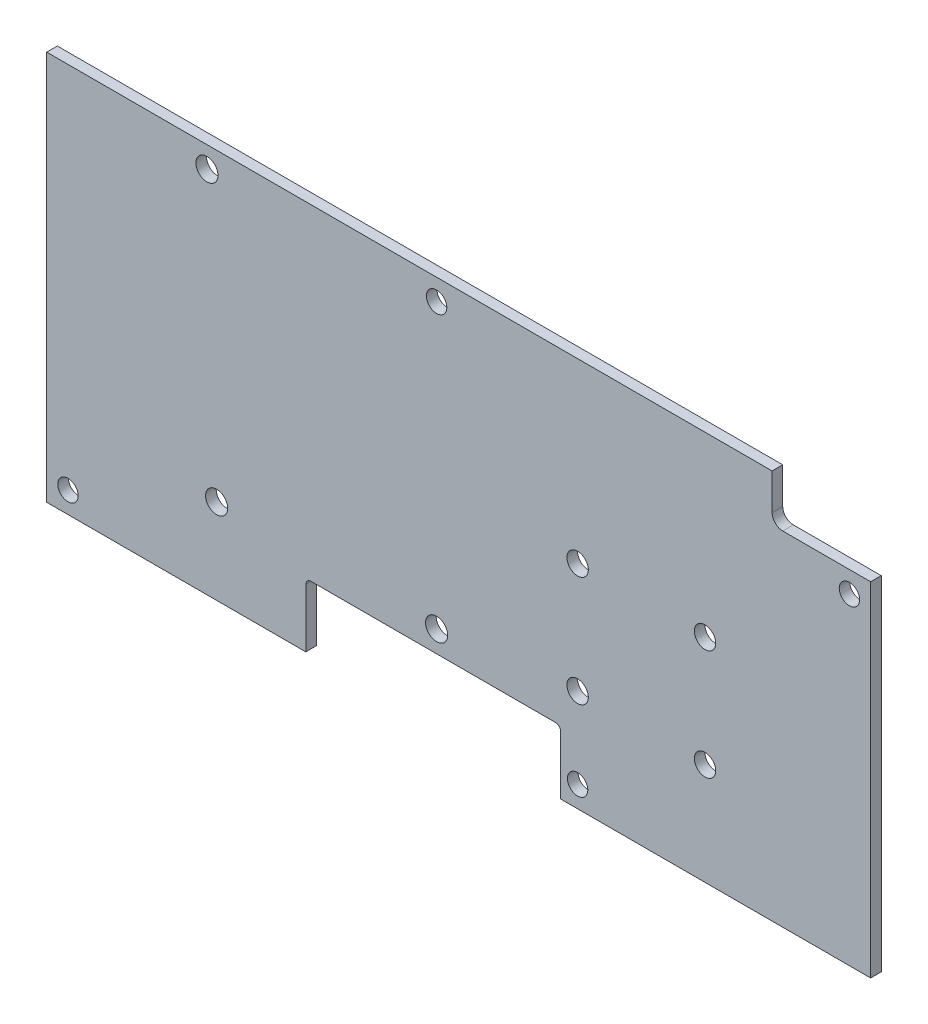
SolidWorks part; units mm, degrees
ref_plane "Front Plane" through (0, 0, 0) normal (0, 0, 1) x (1, 0, 0)
ref_plane "Top Plane" through (0, 0, 0) normal (0, 1, 0) x (1, 0, 0)
ref_plane "Right Plane" through (0, 0, 0) normal (1, 0, 0) x (0, 0, -1)
sketch "Sketch1" plane through (0, 0, 0) normal (0, 0, 1) x (1, 0, 0)
  line L1 (0, 0) -> (167.64, 0)
  line L2 (0, 0) -> (0, 165.1)
  line L3 (0, 165.1) -> (167.64, 165.1)
  line L4 (167.64, 0) -> (167.64, 165.1)
  dimension "D1" = 165.1
  dimension "D2" = 167.64
extrude "pcb" add sketch "Sketch1" along normal blind 1.5875
sketch "Sketch4" plane through (0, 0, 1.5875) normal (0, 0, 1) x (1, 0, 0)
  line L0 (167.64, 82.55) -> (0, 82.55) construction
  line L1 (167.64, 0) -> (167.64, 165.1) construction
  line L3 (167.64, 165.1) -> (0, 165.1) construction
  line L4 (0, 165.1) -> (0, 0) construction
  line L5 (20.32, 82.55) -> (20.32, 95.25) construction
  circle A0 centre (162.8775, 95.25) radius 1.524
  circle A1 centre (162.8775, 69.85) radius 1.524
  circle A2 centre (163.83, 161.29) radius 1.524
  circle A3 centre (163.83, 3.81) radius 1.524
  circle A4 centre (3.81, 161.29) radius 1.524
  circle A5 centre (3.81, 3.81) radius 1.524
  circle A6 centre (162.8775, 82.55) radius 1.524
  circle A7 centre (20.32, 95.25) radius 1.524
  circle A8 centre (20.32, 82.55) radius 1.524
  circle A9 centre (20.32, 69.85) radius 1.524
  dimension "D1" = 3.048
  dimension "D4" = 3.048
  dimension "D5" = 3.81
  dimension "D6" = 3.81
  dimension "D7" = 3.048
  dimension "D8" = 3.81
  dimension "D9" = 3.81
  dimension "D10" = 3.048
  dimension "D13" = 3.048
  dimension "D14" = 3.048
  dimension "D2" = 12.7
  dimension "D3" = 4.7625
  dimension "D11" = 12.7
  dimension "D12" = 20.32
extrude "mount_holes" cut sketch "Sketch4" against normal blind 3.175
sketch "Sketch5" plane through (0, 0, 1.5875) normal (0, 0, 1) x (1, 0, 0)
  line L0 (0, 165.1) -> (0, 0) construction
  line L1 (1.27, 90.17) -> (13.97, 90.17)
  line L2 (1.27, 90.17) -> (1.27, 55.88)
  line L3 (1.27, 55.88) -> (13.97, 55.88)
  line L4 (13.97, 90.17) -> (13.97, 55.88)
  line L5 (0, 0) -> (167.64, 0) construction
  dimension "D1" = 12.7
  dimension "D2" = 34.29
  dimension "D3" = 1.27
  dimension "D4" = 55.88
extrude "20pinMicrofit" add sketch "Sketch5" along normal blind 7.62
sketch "Sketch6" plane through (0, 0, 1.5875) normal (0, 0, 1) x (1, 0, 0)
  line L1 (1.27, 33.02) -> (13.97, 33.02)
  line L2 (1.27, 33.02) -> (1.27, 53.34)
  line L3 (1.27, 53.34) -> (13.97, 53.34)
  line L4 (13.97, 33.02) -> (13.97, 53.34)
  line L5 (0, 165.1) -> (0, 0) construction
  line L6 (0, 0) -> (167.64, 0) construction
  dimension "D1" = 20.32
  dimension "D2" = 12.7
  dimension "D3" = 33.02
  dimension "D4" = 1.27
extrude "sbeRibbon" add sketch "Sketch6" along normal blind 9.144
sketch "Sketch7" plane through (0, 0, 1.5875) normal (0, 0, 1) x (1, 0, 0)
  line L0 (0, 165.1) -> (0, 0) construction
  line L1 (1.27, 20.32) -> (13.97, 20.32)
  line L2 (1.27, 20.32) -> (1.27, 30.48)
  line L3 (1.27, 30.48) -> (13.97, 30.48)
  line L4 (13.97, 20.32) -> (13.97, 30.48)
  line L5 (0, 0) -> (167.64, 0) construction
  dimension "D1" = 12.7
  dimension "D2" = 10.16
  dimension "D3" = 1.27
  dimension "D4" = 20.32
extrude "4pinMicrofit" add sketch "Sketch7" along normal blind 7.62
sketch "Sketch8" plane through (0, 0, 1.5875) normal (0, 0, 1) x (1, 0, 0)
  line L0 (0, 165.1) -> (0, 0) construction
  line L1 (1.27, 7.62) -> (11.43, 7.62)
  line L2 (1.27, 7.62) -> (1.27, 17.78)
  line L3 (1.27, 17.78) -> (11.43, 17.78)
  line L4 (11.43, 7.62) -> (11.43, 17.78)
  line L6 (0, 0) -> (167.64, 0) construction
  dimension "D1" = 10.16
  dimension "D2" = 10.16
  dimension "D3" = 1.27
  dimension "D4" = 7.62
extrude "2pinMicrofit" add sketch "Sketch8" along normal blind 5.08
sketch "Sketch9" plane through (0, 0, 1.5875) normal (0, 0, 1) x (1, 0, 0)
  line L0 (0, 0) -> (167.64, 0) construction
  line L1 (0, 165.1) -> (0, 0) construction
  line L2 (27.94, 8.89) -> (104.14, 8.89) construction
  line L3 (27.94, 8.89) -> (27.94, 52.07) construction
  line L4 (27.94, 52.07) -> (104.14, 52.07) construction
  line L5 (104.14, 8.89) -> (104.14, 52.07) construction
  circle A0 centre (27.94, 8.89) radius 1.524
  circle A1 centre (27.94, 52.07) radius 1.524
  circle A2 centre (104.14, 52.07) radius 1.524
  circle A3 centre (104.14, 8.89) radius 1.524
  dimension "D1" = 3.048
  dimension "D2" = 3.048
  dimension "D3" = 3.048
  dimension "D4" = 3.048
  dimension "D6" = 43.18
  dimension "D5" = 8.89
  dimension "D7" = 76.2
  dimension "D8" = 27.94
extrude "hyd_board_holes" cut sketch "Sketch9" against normal blind 10.16
sketch "Sketch10" plane through (0, 0, 1.5875) normal (0, 0, 1) x (1, 0, 0)
  line L0 (0, 165.1) -> (0, 0) construction
  line L1 (167.64, 165.1) -> (0, 165.1) construction
  line L2 (144.78, 161.29) -> (144.78, 129.159) construction
  line L3 (144.78, 129.159) -> (0, 129.159) construction
  circle A0 centre (144.78, 161.29) radius 1.524
  circle A1 centre (83.058, 154.305) radius 1.524
  circle A2 centre (14.732, 153.035) radius 1.524
  circle A3 centre (144.78, 97.028) radius 1.524
  circle A4 centre (83.058, 104.013) radius 1.524
  circle A5 centre (14.732, 105.283) radius 1.524
  dimension "D1" = 3.048
  dimension "D3" = 3.81
  dimension "D5" = 3.048
  dimension "D6" = 3.048
  dimension "D7" = 25.146
  dimension "D8" = 23.876
  dimension "D10" = 68.326
  dimension "D2" = 144.78
  dimension "D4" = 32.131
  dimension "D9" = 61.722
extrude "sbd_mount_holes" cut sketch "Sketch10" against normal blind 5.588
sketch "Sketch11" plane through (0, 0, 1.5875) normal (0, 0, 1) x (1, 0, 0)
  line L0 (0, 165.1) -> (0, 0) construction
  line L1 (63.5, 146.05) -> (127, 146.05) construction
  line L2 (63.5, 146.05) -> (63.5, 120.65) construction
  line L3 (63.5, 120.65) -> (127, 120.65) construction
  line L4 (127, 146.05) -> (127, 120.65) construction
  line L5 (167.64, 165.1) -> (0, 165.1) construction
  line L6 (127, 146.05) -> (127, 152.4) construction
  line L7 (127, 133.35) -> (63.5, 133.35) construction
  circle A0 centre (63.5, 146.05) radius 1.524
  circle A1 centre (127, 152.4) radius 1.524
  circle A2 centre (63.5, 120.65) radius 1.524
  circle A3 centre (127, 114.3) radius 1.524
  dimension "D6" = 3.048
  dimension "D7" = 3.048
  dimension "D8" = 3.048
  dimension "D1" = 63.5
  dimension "D2" = 63.5
  dimension "D3" = 25.4
  dimension "D4" = 19.05
  dimension "D5" = 6.35
extrude "gps_mount_holes" cut sketch "Sketch11" against normal blind 5.588
sketch "Sketch12" plane through (0, 0, 0) normal (0, 0, -1) x (-1, 0, 0)
  line L0 (-167.64, 165.1) -> (0, 165.1) construction
  line L1 (-137.16, 163.195) -> (-121.412, 163.195)
  line L2 (-137.16, 163.195) -> (-137.16, 158.115)
  line L3 (-137.16, 158.115) -> (-121.412, 158.115)
  line L4 (-121.412, 163.195) -> (-121.412, 158.115)
  line L5 (-167.64, 0) -> (-167.64, 165.1) construction
  dimension "D1" = 15.748
  dimension "D2" = 5.08
  dimension "D3" = 6.985
  dimension "D4" = 30.48
extrude "sbd_conn" add sketch "Sketch12" along normal blind 9.906
sketch "Sketch13" plane through (0, 0, 0) normal (0, 0, -1) x (-1, 0, 0)
  line L0 (-167.64, 0) -> (-167.64, 165.1) construction
  line L1 (-161.29, 7.62) -> (-147.32, 7.62)
  line L2 (-161.29, 7.62) -> (-161.29, 20.32)
  line L3 (-161.29, 20.32) -> (-147.32, 20.32)
  line L4 (-147.32, 7.62) -> (-147.32, 20.32)
  line L5 (0, 0) -> (-167.64, 0) construction
  dimension "D1" = 13.97
  dimension "D2" = 12.7
  dimension "D3" = 6.35
  dimension "D4" = 7.62
extrude "compass_conn" add sketch "Sketch13" along normal blind 6.35
sketch "Sketch14" plane through (0, 0, 0) normal (0, 0, -1) x (-1, 0, 0)
  line L0 (-167.64, 0) -> (-167.64, 165.1) construction
  line L1 (-158.75, 21.59) -> (-146.05, 21.59)
  line L2 (-158.75, 21.59) -> (-158.75, 41.91)
  line L3 (-158.75, 41.91) -> (-146.05, 41.91)
  line L4 (-146.05, 21.59) -> (-146.05, 41.91)
  line L5 (0, 0) -> (-167.64, 0) construction
  dimension "D1" = 20.32
  dimension "D2" = 12.7
  dimension "D3" = 8.89
  dimension "D4" = 21.59
extrude "roll_conn" add sketch "Sketch14" along normal blind 8.89
sketch "Sketch15" plane through (0, 0, 0) normal (0, 0, -1) x (-1, 0, 0)
  line L0 (-167.64, 0) -> (-167.64, 165.1) construction
  line L1 (-158.75, 43.18) -> (-146.05, 43.18)
  line L2 (-158.75, 43.18) -> (-158.75, 63.5)
  line L3 (-158.75, 63.5) -> (-146.05, 63.5)
  line L4 (-146.05, 43.18) -> (-146.05, 63.5)
  line L5 (-146.05, 41.91) -> (-158.75, 41.91) construction
  dimension "D1" = 20.32
  dimension "D2" = 12.7
  dimension "D3" = 8.89
  dimension "D4" = 1.27
extrude "pitch_conn" add sketch "Sketch15" along normal blind 8.89
sketch "Sketch16" plane through (0, 0, 1.5875) normal (0, 0, 1) x (1, 0, 0)
  line L1 (24.765, 48.895) -> (147.955, 48.895)
  line L2 (24.765, 48.895) -> (24.765, 107.188)
  line L3 (24.765, 107.188) -> (147.955, 107.188)
  line L4 (147.955, 48.895) -> (147.955, 107.188)
  circle A0 centre (27.94, 52.07) radius 1.524 construction
  circle A1 centre (83.058, 104.013) radius 1.524 construction
  circle A2 centre (144.78, 97.028) radius 1.524 construction
  dimension "D1" = 3.175
  dimension "D2" = 3.175
  dimension "D3" = 3.175
  dimension "D4" = 3.175
extrude "Cut-Extrude2" cut sketch "Sketch16" against normal through all and the other way through all flip side to cut
sketch "Sketch17" plane through (0, 0, 0) normal (0, 0, -1) x (-1, 0, 0)
  line L1 (-143.6712, 65.963) -> (-153.0129, 65.963)
  line L2 (-143.6712, 65.963) -> (-143.6712, 43.8972)
  line L3 (-143.6712, 43.8972) -> (-153.0129, 43.8972)
  line L4 (-153.0129, 65.963) -> (-153.0129, 43.8972)
extrude "Cut-Extrude3" cut sketch "Sketch17" along normal through all
sketch "Sketch18" plane through (0, 0, 1.5875) normal (0, 0, 1) x (1, 0, 0)
  line L0 (147.955, 107.188) -> (147.955, 48.895) construction
  line L1 (150.8146, 100.203) -> (133.223, 100.203)
  line L2 (150.8146, 100.203) -> (150.8146, 111.6624)
  line L3 (150.8146, 111.6624) -> (133.223, 111.6624)
  line L4 (133.223, 100.203) -> (133.223, 111.6624)
  circle A0 centre (144.78, 97.028) radius 1.524 construction
  dimension "D1" = 3.175
  dimension "D2" = 14.732
extrude "Cut-Extrude4" cut sketch "Sketch18" against normal through all
fillet "Fillet1" radius 1.5875 1 edges at (133.223, 100.203, 0.7937)
sketch "Sketch19" plane through (0, 0, 1.5875) normal (0, 0, 1) x (1, 0, 0)
  circle A7 centre (48.7172, 104.013) radius 1.651
  circle A8 centre (83.058, 104.013) radius 1.524 construction
  circle A9 centre (50.165, 61.6458) radius 1.651
  circle A10 centre (83.058, 61.6458) radius 1.651
  dimension "D1" = 34.3408
  dimension "D2" = 42.3672
  dimension "D3" = 32.893
extrude "isfet holes" cut sketch "Sketch19" against normal through all
sketch "Sketch20" plane through (0, 0, 1.5875) normal (0, 0, 1) x (1, 0, 0)
  line L0 (147.955, 48.895) -> (24.765, 48.895) construction
  circle A0 centre (104.14, 64.135) radius 1.6002
  circle A1 centre (104.14, 80.645) radius 1.6002
  circle A2 centre (123.19, 64.135) radius 1.6002
  circle A3 centre (123.19, 80.645) radius 1.6002
  dimension "D1" = 16.51
  dimension "D2" = 15.24
  dimension "D3" = 16.51
  dimension "D4" = 19.05
extrude "Cut-Extrude6" cut sketch "Sketch20" against normal through all
sketch "Sketch21" plane through (0, 0, 1.5875) normal (0, 0, 1) x (1, 0, 0)
  line L0 (147.955, 48.895) -> (24.765, 48.895) construction
  line L1 (101.6, 46.8738) -> (63.5, 46.8738)
  line L2 (101.6, 46.8738) -> (101.6, 58.42)
  line L3 (101.6, 58.42) -> (63.5, 58.42)
  line L4 (63.5, 46.8738) -> (63.5, 58.42)
  circle A0 centre (104.14, 52.07) radius 1.524 construction
  dimension "D1" = 2.54
  dimension "D2" = 9.525
  dimension "D3" = 38.1
extrude "Cut-Extrude7" cut sketch "Sketch21" against normal through all
fillet "Fillet2" radius 0.7937 2 edges at (101.6, 58.42, 0.7937) (63.5, 58.42, 0.7937)
